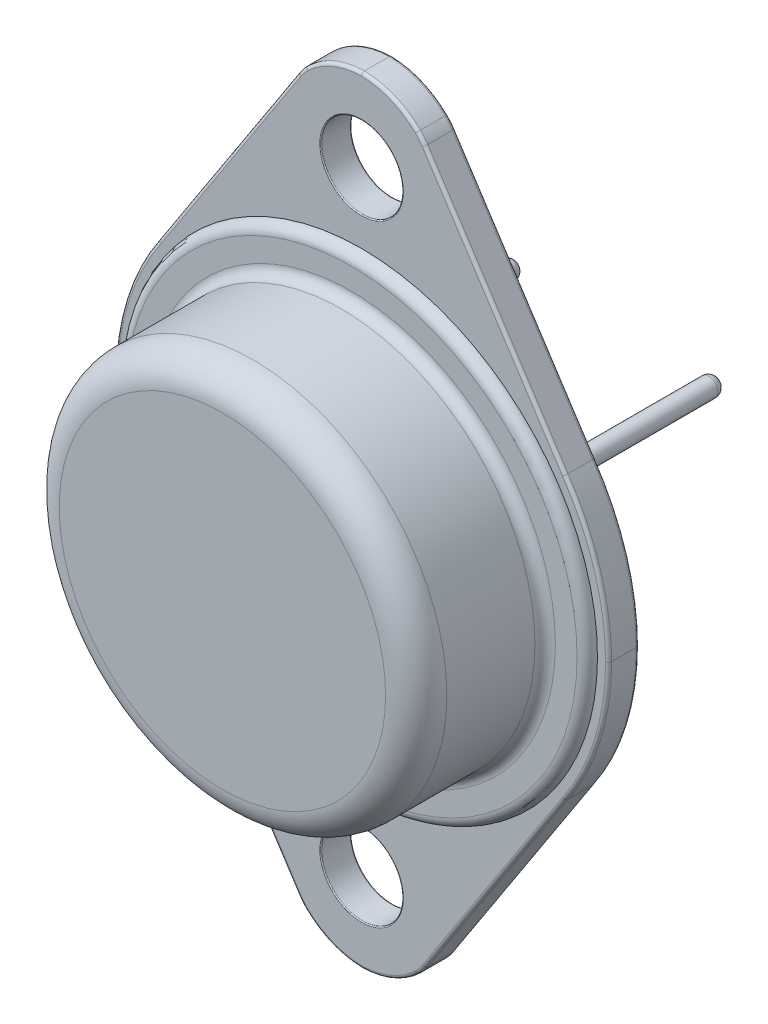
SolidWorks part; units mm, degrees
ref_plane "Piano frontale" through (0, 0, 0) normal (0, 0, 1) x (1, 0, 0)
ref_plane "Piano superiore" through (0, 0, 0) normal (0, 1, 0) x (1, 0, 0)
ref_plane "Piano destro" through (0, 0, 0) normal (1, 0, 0) x (0, 0, -1)
imported_body "Importato1"
imported_body "Importato2"
imported_body "Importato3"
fillet "Raccordo9" radius 0.15
fillet "Raccordo18" radius 0.5 1 edges at (11.565, 0, 2)
fillet "Raccordo20" radius 0.15 8 edges at (-11.5632, -3.6168, 0) (-2.9341, -17.6814, 0) (-6.5355, -12.1832, 0) (-1.4806, -18.7177, 0) (1.4806, -18.7177, 0) (2.9341, -17.6814, 0) (11.5632, -3.6168, 0) (6.5355, -12.1832, 0)
fillet "Raccordo22" radius 0.05 1 edges at (2, -15, 1.5)
fillet "Raccordo23" radius 0.05 1 edges at (2, 15, 1.5)
fillet "Raccordo24" radius 0.05 2 edges at (2, 15, 0) (2, -15, 0)
